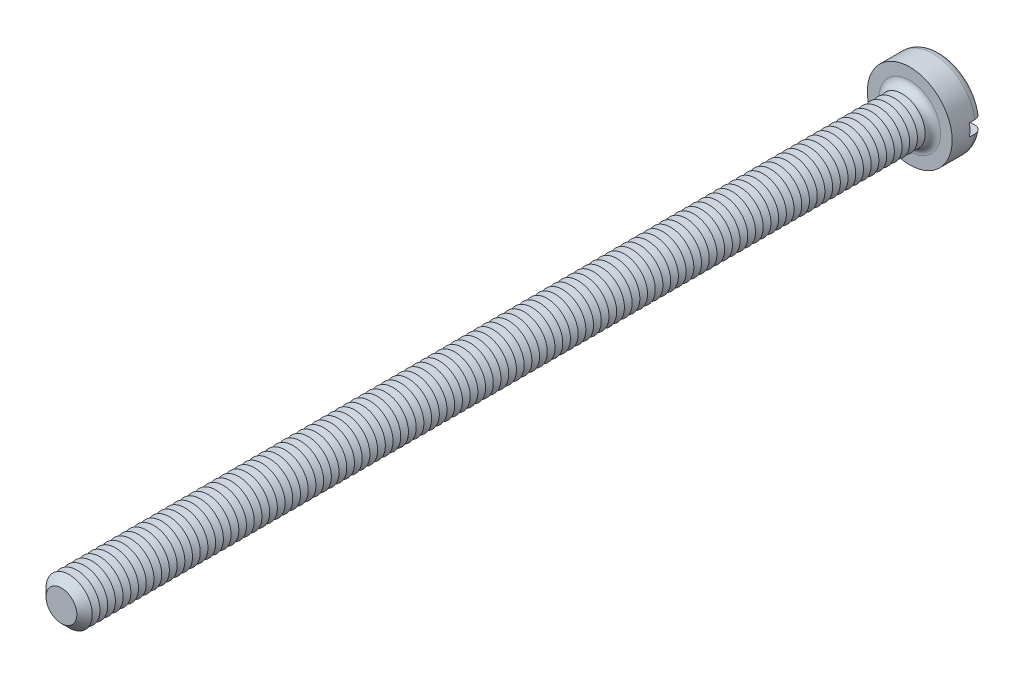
SolidWorks part; units mm, degrees
ref_plane "Front Plane" through (0, 0, 0) normal (0, 0, 1) x (1, 0, 0)
ref_plane "Top Plane" through (0, 0, 0) normal (0, 1, 0) x (1, 0, 0)
ref_plane "Right Plane" through (0, 0, 0) normal (1, 0, 0) x (0, 0, -1)
sketch "Sketch3" plane through (0, 0, 0) normal (0, 0, 1) x (1, 0, 0)
  circle A0 centre (0, 0) radius 2.75
  dimension "D1" = 5.5
extrude "Boss-Extrude2" add sketch "Sketch3" against normal blind 2
sketch "Sketch4" plane through (0, 0, 0) normal (0, 0, 1) x (1, 0, 0)
  circle A0 centre (0, 0) radius 1.5
  dimension "D1" = 3
extrude "Boss-Extrude3" add sketch "Sketch4" along normal blind 55
fillet "Fillet1" radius 0.5 2 edges at (2.75, 0, -2) (1.5, 0, 0)
chamfer "Chamfer1" distance 0.5 angle 45 1 edges at (1.5, 0, 55)
sketch "Sketch5" plane through (0, 0, 0) normal (1, 0, 0) x (0, 0, -1)
  line L0 (1.6944, 0) -> (-7.6738, 0) construction
sketch "Sketch6" plane through (0, 0, 0) normal (1, 0, 0) x (0, 0, -1)
  line L0 (-0.5, 1.5) -> (-0.75, 1.067)
  line L1 (-0.75, 1.067) -> (-1, 1.5)
  line L2 (-0.5, 1.5) -> (-54.5, 1.5) construction
  line L3 (-1, 1.5) -> (-0.5, 1.5)
  dimension "D1" = 0.5
revolve "Cut-Revolve1" cut sketch "Sketch6" angle 360 about L0
pattern_linear "LPattern1" count 108 spacing 0.5 along (0, 0, 1) of "Cut-Revolve1"
sketch "Sketch8" plane through (0, 0, -2) normal (0, 0, -1) x (-1, 0, 0)
  line L1 (2.75, -0.4) -> (-2.75, -0.4)
  line L2 (2.75, -0.4) -> (2.75, 0.4)
  line L3 (2.75, 0.4) -> (-2.75, 0.4)
  line L4 (-2.75, -0.4) -> (-2.75, 0.4)
  line L5 (2.75, -0.4) -> (-2.75, 0.4) construction
  line L6 (2.75, 0.4) -> (-2.75, -0.4) construction
  point P0 (0, 0)
  dimension "D1" = 5.5
  dimension "D2" = 0.8
extrude "Cut-Extrude1" cut sketch "Sketch8" against normal blind 0.85
